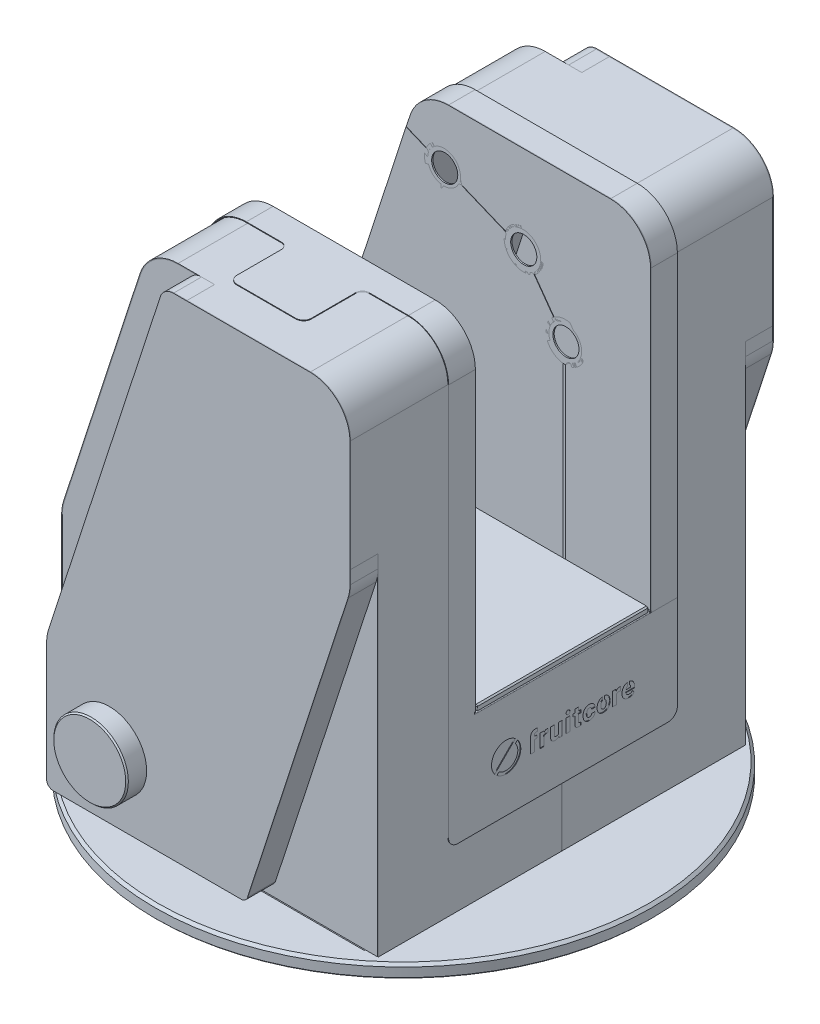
SolidWorks part; units mm, degrees
ref_plane "Ebene vorne" through (0, 0, 0) normal (0, 0, 1) x (1, 0, 0)
ref_plane "Ebene oben" through (0, 0, 0) normal (0, 1, 0) x (1, 0, 0)
ref_plane "Ebene rechts" through (0, 0, 0) normal (1, 0, 0) x (0, 0, -1)
imported_body "Platte1-2-surface1"
imported_body "Platte1-2-surface2"
imported_body "Platte166-1-surface1"
imported_body "Platte167-2-surface1"
imported_body "190911_001_B-1-surface1"
imported_body "190911_001_B-1-surface2"
imported_body "190911_001_B-1-surface3"
imported_body "190911_002_B-1-surface1"
imported_body "190911_002_B-1-surface2"
imported_body "190911_002_B-1-surface3"
imported_body "190911_002_B-1-surface4"
imported_body "190911_002_B-1-surface5"
imported_body "190911_003_B-1-surface1"
imported_body "190911_003_B-1-surface2"
imported_body "190911_003_B-1-surface3"
imported_body "190911_003_B-1-surface4"
imported_body "190911_003_B-1-surface5"
imported_body "190911_003_B-1-surface6"
imported_body "190911_003_B-1-surface7"
imported_body "190911_003_B-1-surface8"
imported_body "190911_004_B-1-surface1"
imported_body "190911_004_B-1-surface2"
imported_body "190911_004_B-1-surface3"
imported_body "190911_004_B-1-surface4"
imported_body "190911_004_B-1-surface5"
imported_body "190911_004_B-1-surface6"
imported_body "190911_004_B-1-surface7"
imported_body "190911_004_B-1-surface8"
imported_body "Platte125-1-surface1"
imported_body "Platte125-2-surface1"
sketch "Skizze1" plane through (0, -177.2, 0) normal (0, 1, 0) x (1, 0, 0)
  line L4 (-50.05, 14.9712) -> (-50.05, -15.0288)
  line L5 (-40.05, -25.0288) -> (-10.05, -25.0288)
  line L6 (-0.05, -15.0288) -> (-0.05, 14.9712)
  line L7 (-10.05, 24.9712) -> (-40.05, 24.9712)
  line L8 (-50.05, 14.9712) -> (-50.05, -15.0288)
  line L9 (-40.05, -25.0288) -> (-10.05, -25.0288)
  line L10 (-0.05, -15.0288) -> (-0.05, 14.9712)
  line L11 (-10.05, 24.9712) -> (-40.05, 24.9712)
  arc A4 (-50.05, -15.0288) -> (-40.05, -25.0288) centre (-40.05, -15.0288) ccw
  arc A5 (-10.05, -25.0288) -> (-0.05, -15.0288) centre (-10.05, -15.0288) ccw
  arc A6 (-0.05, 14.9712) -> (-10.05, 24.9712) centre (-10.05, 14.9712) ccw
  arc A7 (-40.05, 24.9712) -> (-50.05, 14.9712) centre (-40.05, 14.9712) ccw
  arc A8 (-50.05, -15.0288) -> (-40.05, -25.0288) centre (-40.05, -15.0288) ccw
  arc A9 (-10.05, -25.0288) -> (-0.05, -15.0288) centre (-10.05, -15.0288) ccw
  arc A10 (-0.05, 14.9712) -> (-10.05, 24.9712) centre (-10.05, 14.9712) ccw
  arc A11 (-40.05, 24.9712) -> (-50.05, 14.9712) centre (-40.05, 14.9712) ccw
  dimension "D1" = 0
extrude "Aufsatz-Linear austragen1" add sketch "Skizze1" against normal blind 10
sketch "Skizze2" plane through (0, 0, -66.9462) normal (0, 0, 1) x (1, 0, 0)
  line L0 (-25.05, -221.1174) -> (-25.05, -402.545) construction
  line L1 (-20.6514, -318) -> (249.4777, -318) construction
  line L2 (-213.05, -318) -> (162.95, -318) construction
  line L3 (164.95, -327) -> (164.95, -320) construction
  line L4 (-215.05, -320) -> (-215.05, -327) construction
  circle A0 centre (-60.9, 24.0747) radius 15
  circle A1 centre (0, 0) radius 15
  circle A2 centre (31.8, -45.4253) radius 15
  circle A3 centre (-60.46, 24.01) radius 10
  circle A4 centre (0, 0) radius 10
  circle A5 centre (32.28, -45.01) radius 10
  point P21 (86.004, -318)
  point P22 (-20.6514, -318)
  dimension "D1" = 30
  dimension "D8" = 20
  dimension "D2" = 57.33
  dimension "D3" = 25.05
  dimension "D4" = 35.41
  dimension "D5" = 272.99
  dimension "D6" = 318
  dimension "D7" = 342.01
extrude "Aufsatz-Linear austragen2" add sketch "Skizze2" against normal blind 1 separate body
